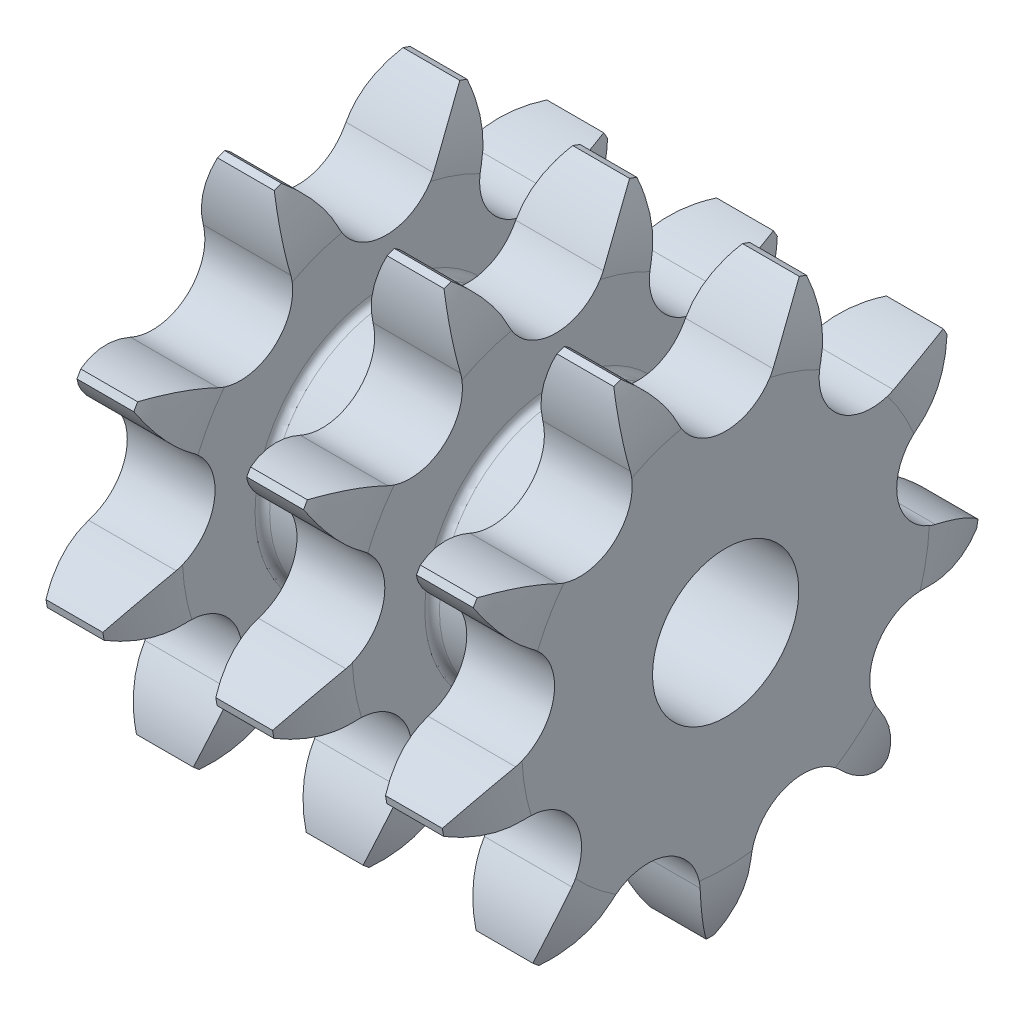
SolidWorks part; units mm, degrees
ref_plane "Plane1" through (0, 0, 0) normal (0, 0, 1) x (1, 0, 0)
ref_plane "Plane2" through (0, 0, 0) normal (0, 1, 0) x (1, 0, 0)
ref_plane "Plane3" through (0, 0, 0) normal (1, 0, 0) x (0, 0, -1)
sketch "Clipboard" plane through (0, 0, 0) normal (0, 1, 0) x (1, 0, 0)
  line L0 (0, 0) -> (12.5436, -1.9867)
  line L1 (-15, 0) -> (100, 0) construction
  line L2 (0, 0) -> (-0.8416, 0.9512)
  line L3 (0, 0) -> (-11.863, 4.5341)
  line L4 (0, 0) -> (3.0618, 0.4849)
  line L5 (0, 0) -> (-2.8109, -1.0484)
  line L6 (0, 0) -> (-29.0469, -19.598)
  line L7 (-0.8416, 0.9512) -> (35.5852, 8.6939)
  line L8 (-76.2, 38.1) -> (-75.2, 38.1)
  line L9 (-73.4259, 41.6592) -> (-72.8306, 41.7344)
  line L10 (-73.4741, 12.7512) -> (-59.5541, 12.7512)
  circle A0 centre (0, 0) radius 4.255
  circle A1 centre (0, 0) radius 10.1515
  circle A2 centre (0, 0) radius 25
sketch "BasProSke" plane through (0, 0, 0) normal (0, 1, 0) x (1, 0, 0)
  line L0 (-10, 0) -> (60, 0) construction
  line L1 (0, 0) -> (0, 16.7129)
  line L2 (0, 0) -> (35.04, 0)
  line L3 (35.04, 0) -> (35.04, 16.7129)
  line L4 (33.77, 22.2487) -> (1.27, 22.2487)
  arc A0 (0, 16.7129) -> (1.27, 22.2487) centre (12.7, 16.7129) cw
  arc A1 (35.04, 16.7129) -> (33.77, 22.2487) centre (22.34, 16.7129) ccw
revolve "Base-Revolve" add sketch "BasProSke" angle 360 about L0
sketch "GrvSke" plane through (0, 0, 0) normal (0, 1, 0) x (1, 0, 0)
  line L0 (7.2, 16.7129) -> (7.2, 10.7515)
  line L1 (7.8, 10.1515) -> (13.32, 10.1515)
  line L2 (13.92, 10.7515) -> (13.92, 16.7129)
  line L3 (5.93, 22.2487) -> (15.19, 22.2487)
  line L4 (10.56, 0) -> (10.56, 52.07) construction
  line L5 (-10, 0) -> (60, 0) construction
  line L6 (0, 0) -> (35.56, 0) construction
  arc A0 (13.92, 16.7129) -> (15.19, 22.2487) centre (26.62, 16.7129) cw
  arc A1 (7.2, 16.7129) -> (5.93, 22.2487) centre (-5.5, 16.7129) ccw
  arc A2 (7.2, 10.7515) -> (7.8, 10.1515) centre (7.8, 10.7515) ccw
  arc A3 (13.32, 10.1515) -> (13.92, 10.7515) centre (13.32, 10.7515) ccw
revolve "Groove" cut sketch "GrvSke" angle 360 about L6
pattern_linear "Grooves" count 2 spacing 13.92 along (1, 0, 0) of "Groove"
sketch "TooCutSke" plane through (0, 0, 0) normal (1, 0, 0) x (0, 0, -1)
  line L0 (0, 18.6087) -> (3.8949, 16.7925) construction
  line L1 (0, 0) -> (0, 107) construction
  line L2 (0, 18.6087) -> (-10, 18.6087) construction
  line L3 (0, 18.6087) -> (-3.8949, 16.7925) construction
  arc A0 (3.8949, 16.7925) -> (7.8075, 21.3669) centre (14.0756, 12.0451) cw
  arc A1 (3.8949, 16.7925) -> (-3.8949, 16.7925) centre (0, 18.6087) cw
  arc A2 (-3.8949, 16.7925) -> (-7.8075, 21.3669) centre (-14.0756, 12.0451) ccw
  arc A3 (7.8075, 21.3669) -> (-7.8075, 21.3669) centre (0, 0) ccw
extrude "ToothCut" cut sketch "TooCutSke" along normal through all
pattern_circular "TeethCuts" count 9 every 40 about axis through (-10, 0, 0) along (1, 0, 0) of "ToothCut"
sketch "HubNeaOneSke" plane through (0, 0, 0) normal (-1, 0, 0) x (0, 0, 1)
  circle A0 centre (0, 0) radius 10.1515
extrude "HubNearOne" [suppressed] add sketch "HubNeaOneSke" along normal blind 2.2005
fillet "HubNearOneFillet" [suppressed] radius 0.6
sketch "HubNeaBotSke" plane through (0, 0, 0) normal (-1, 0, 0) x (0, 0, 1)
  circle A0 centre (0, 0) radius 10.1515
extrude "HubNearBoth" [suppressed] add sketch "HubNeaBotSke" along normal blind 1.1003
fillet "HubNearBothFillet" [suppressed] radius 0.6
ref_plane "FarPln" through (35.04, 0, 0) normal (1, 0, 0) x (0, 0, -1)
sketch "HubFarSke" plane through (35.04, 0, 0) normal (1, 0, 0) x (0, 0, -1)
  circle A0 centre (0, 0) radius 10.1515
extrude "HubFar" [suppressed] add sketch "HubFarSke" along normal blind 1.1003
fillet "HubFarFillet" [suppressed] radius 0.6
sketch "BorSke" plane through (0, 0, 0) normal (1, 0, 0) x (0, 0, -1)
  circle A0 centre (0, 0) radius 6
extrude "Bore" cut sketch "BorSke" along normal mid plane 74.481
sketch "KeySke" plane through (0, 0, 0) normal (1, 0, 0) x (0, 0, -1)
  line L0 (-1, 0) -> (-1, 7)
  line L1 (-1, 7) -> (1, 7)
  line L2 (1, 7) -> (1, 0)
  line L3 (0, 0) -> (0, 34) construction
  line L4 (-1, 0) -> (1, 0)
extrude "Keyway" [suppressed] cut sketch "KeySke" along normal mid plane 74.481
pattern_circular "Keyway2" [suppressed] count 2 every 90 about axis through (-10, 0, 0) along (1, 0, 0)
equation "\"Num_teethClipboard_v1\" =  int( \"Num_teeth@Clipboard\" )"
equation "\"Num_teethClipboard_v2\" =  ((sgn( \"Num_teethClipboard_v1\" - 5.0)+1)*( \"Num_teethClipboard_v1\" - 5.0))/2 +5.0"
equation "\"Num_teeth@Clipboard\" =  ((sgn( \"Num_teethClipboard_v2\" - 200.0)-1)*( \"Num_teethClipboard_v2\" - 200.0))/-2 +200.0"
equation "\"MHDClipboard_v1\" =  \"Pitch@Clipboard\" * (1.0 / tan(3.14159265 / \"Num_teeth@Clipboard\" )) - 1.05 * \"Plate_wid@Clipboard\" - 2.0 * \"Fillet_rad@Clipboard\" - 1.0"
equation "\"Thickness@Clipboard\" =  \"Face_width@Clipboard\" + (\"Num_strands@Clipboard\" - 1) * \"Transv_pitch@Clipboard\""
equation "\"OALClipboard_v1\" =  \"Thickness@Clipboard\" + 2 * \"Fillet_rad@Clipboard\" + 1"
equation "\"MHD@Clipboard\" =  ((sgn( \"MHDClipboard_v1\" - \"Hub_dia@Clipboard\" )-1)*( \"MHDClipboard_v1\" - \"Hub_dia@Clipboard\" ))/-2+ \"Hub_dia@Clipboard\""
equation "\"OAL@Clipboard\" =  ((sgn( \"OALClipboard_v1\" - \"Overall_len@Clipboard\" )+1)*( \"OALClipboard_v1\" - \"Overall_len@Clipboard\" ))/2 + \"Overall_len@Clipboard\" + 0.0005"
equation "\"Num_teethTeethCuts_v1\" =  int( \"Show_teeth@Clipboard\" ) + 1"
equation "\"Num_teethTeethCuts_v2\" =  ((sgn( \"Num_teethTeethCuts_v1\" - \"Num_teeth@Clipboard\" )-1)*( \"Num_teethTeethCuts_v1\" - \"Num_teeth@Clipboard\" ))/-2+ \"Num_teeth@Clipboard\""
equation "\"Num_teeth@TeethCuts\" =  ((sgn( \"Num_teethTeethCuts_v2\" - 2.0)+1)*( \"Num_teethTeethCuts_v2\" - 2.0))/2 +2.0"
equation "\"Angle@TeethCuts\" =  360.0 / \"Num_teeth@Clipboard\""
equation "\"Seat_radius@TooCutSke\" =  ( \"Pitch@Clipboard\" / 2.0) / sin(3.14159265 / \"Num_teeth@Clipboard\" ) - \"Dr@Clipboard\" / 2.0 + \"Dr@Clipboard\" * 0.505"
equation "\"R1@TooCutSke\" =  \"Dr@Clipboard\" * 0.505"
equation "\"X@TooCutSke\" =  140.0 - (90.0 / \"Num_teeth@Clipboard\")"
equation "\"R2@TooCutSke\" =  0.12 * \"Dr@Clipboard\" * ( \"Num_teeth@Clipboard\" + 2.0)"
equation "\"Overcut@TooCutSke\" =  0.5 + 0.625 * \"Pitch@Clipboard\" - 0.5 * \"Dr@Clipboard\"  +  \"Pitch@Clipboard\" / 2.0 / sin(3.14159265 / \"Num_teeth@Clipboard\" )"
equation "\"Diameter@BasProSke\" =  2.0 * ( 0.625 * \"Pitch@Clipboard\" - 0.5 * \"Dr@Clipboard\"  +  \"Pitch@Clipboard\" / 2.0 / sin(3.14159265 / \"Num_teeth@Clipboard\" ))"
equation "\"Thickness@BasProSke\" =  \"Thickness@Clipboard\""
equation "\"G1@BasProSke\" =  \"Side_relief@Clipboard\""
equation "\"G2@BasProSke\" =  \"Side_relief@Clipboard\""
equation "\"D1@BasProSke\" =  \"Side_radius@Clipboard\""
equation "\"Diameter@GrvSke\" =  \"Diameter@BasProSke\""
equation "\"G1@GrvSke\" =  \"Side_relief@Clipboard\""
equation "\"D1@GrvSke\" =  \"Side_radius@Clipboard\""
equation "\"Grv_diam@GrvSke\" =  \"Pitch@Clipboard\" * (1.0 / tan(3.14159265 / \"Num_teeth@Clipboard\" ))- 1.05 * \"Plate_wid@Clipboard\" - 2.0 * \"Fillet_rad@Clipboard\" - 1.0"
equation "\"Grv_width@GrvSke\" =  \"Transv_pitch@Clipboard\" - \"Face_width@Clipboard\""
equation "\"Offset@GrvSke\" =  \"Grv_width@GrvSke\" / 2.0 + \"Face_width@Clipboard\""
equation "\"Fillet_rad@GrvSke\" =  \"Fillet_rad@Clipboard\""
equation "\"Offset@Grooves\" =  \"Transv_pitch@Clipboard\""
equation "\"Num_grvsGrooves_v1\" =  \"Num_strands@Clipboard\""
equation "\"Num_grvs@Grooves\" =  \"Num_grvsGrooves_v1\" - 1 * sgn( \"Num_grvsGrooves_v1\" -1)"
equation "\"Diameter@HubNeaOneSke\" =  \"MHD@Clipboard\""
equation "\"Length@HubNearOne\" =  \"OAL@Clipboard\" - \"Thickness@BasProSke\""
equation "\"Diameter@HubNeaBotSke\" =  \"MHD@Clipboard\""
equation "\"Length@HubNearBoth\" =  ( \"OAL@Clipboard\" - \"Thickness@BasProSke\" ) / 2.0"
equation "\"D1@HubNearOneFillet\" =  \"Fillet_rad@Clipboard\""
equation "\"D1@HubNearBothFillet\" =  \"Fillet_rad@Clipboard\""
equation "\"Thickness@FarPln\" =  \"Thickness@BasProSke\""
equation "\"Diameter@HubFarSke\" =  \"MHD@Clipboard\""
equation "\"Length@HubFar\" =  ( \"OAL@Clipboard\" - \"Thickness@BasProSke\" ) / 2.0"
equation "\"D1@HubFarFillet\" =  \"Fillet_rad@Clipboard\""
equation "\"D1@Bore\" =  \"OAL@Clipboard\" * 2.0"
equation "\"D1@Keyway\" =  \"OAL@Clipboard\" * 2.0"
equation "\"Offset@KeySke\" =  \"T_dim@Clipboard\" + \"Diameter@BorSke\" / 2.0"
